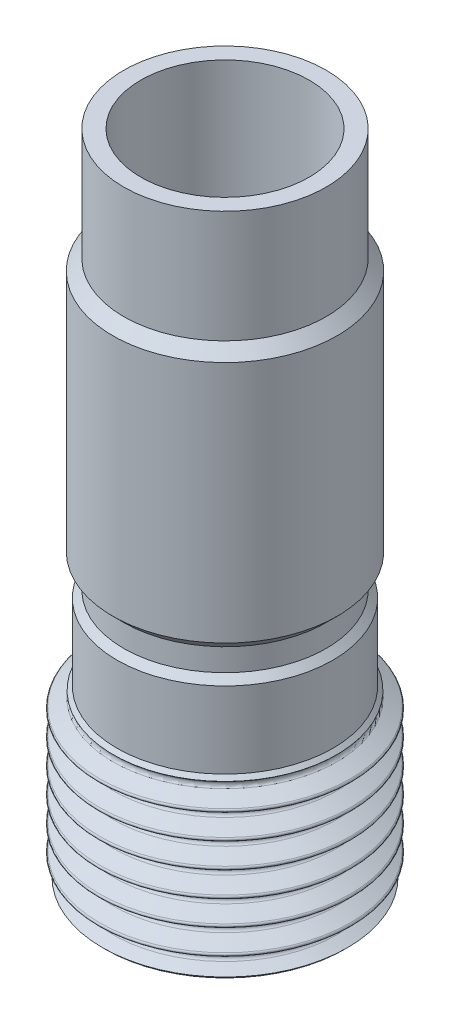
SolidWorks part; units mm, degrees
ref_plane "Front Plane" through (0, 0, 0) normal (0, 0, 1) x (1, 0, 0)
ref_plane "Top Plane" through (0, 0, 0) normal (0, 1, 0) x (1, 0, 0)
ref_plane "Right Plane" through (0, 0, 0) normal (1, 0, 0) x (0, 0, -1)
sketch "Sketch1" plane through (0, 0, 0) normal (0, 0, 1) x (1, 0, 0)
  line L0 (0, 0) -> (0, 31.3505) construction
  line L1 (-4.7625, 0) -> (-4.7625, 15.875)
  line L2 (-4.7625, 0) -> (-7.1438, 0)
  line L3 (-7.1438, 0) -> (-7.1437, 8.49)
  line L4 (-7.1437, 8.49) -> (-6.1087, 9.525)
  line L5 (-6.1087, 9.525) -> (-6.1087, 13.843)
  line L6 (-5.7277, 15.494) -> (-6.35, 16.1163)
  line L7 (-5.7277, 36.83) -> (-5.7277, 30.48)
  line L8 (-5.7277, 30.48) -> (-6.35, 29.8577)
  line L9 (-6.35, 16.1163) -> (-6.35, 29.8577)
  line L10 (-5.7277, 36.83) -> (-4.7625, 36.83)
  line L11 (-5.7277, 15.494) -> (-5.7277, 14.224)
  line L12 (-5.7277, 14.224) -> (-6.1087, 13.843)
  line L13 (-4.7625, 15.875) -> (-2.4257, 15.875)
  line L14 (-2.4257, 15.875) -> (-2.4257, 23.9959)
  line L15 (-2.4257, 23.9959) -> (-4.7625, 25.4)
  line L16 (-4.7625, 25.4) -> (-4.7625, 36.83)
  dimension "D1" = 14.2875
  dimension "D2" = 9.525
  dimension "D3" = 12.2174
  dimension "D4" = 45
  dimension "D5" = 27.305
  dimension "D6" = 1.27
  dimension "D7" = 12.7
  dimension "D8" = 36.83
  dimension "D9" = 11.4554
  dimension "D10" = 6.35
  dimension "D11" = 21.336
  dimension "D12" = 59
  dimension "D13" = 4.8514
  dimension "D14" = 15.875
  dimension "D15" = 25.4
revolve "Revolve1" add sketch "Sketch1" angle 360 about L0
chamfer "Chamfer1" distance 0.381 angle 45 2 edges at (0, 0, -7.1438) (0, 0, -4.7625)
ref_axis "Axis1" through (0, 15.4479, 0) along (0, -1, 0)
sketch "Sketch3" plane through (0, 0, 0) normal (0, 0, 1) x (1, 0, 0)
  line L0 (0, 0) -> (0, -6.3978) construction
  line L1 (-6.329, 9.3204) -> (-6.329, 8.9676) construction
  line L3 (-6.329, 8.9676) -> (-6.0235, 9.144) construction
  line L4 (-6.0235, 9.144) -> (-6.329, 9.3204) construction
  line L5 (-6.7628, 0) -> (6.7628, 0) construction
  line L6 (-7.0928, 8.5266) -> (-6.329, 8.9676)
  line L8 (-6.329, 9.3204) -> (-7.0928, 9.7614)
  line L9 (-7.1437, 9.8496) -> (-7.1437, 8.4384)
  line L10 (-6.2272, 9.144) -> (0, 9.144) construction
  line L13 (0, 9.144) -> (6.2272, 9.144) construction
  line L14 (0, 15.4479) -> (0, -2.4123) construction
  arc A0 (-6.329, 9.3204) -> (-6.329, 8.9676) centre (-6.4309, 9.144) cw
  arc A1 (-7.1437, 9.8496) -> (-7.0928, 9.7614) centre (-7.0419, 9.8496) ccw
  arc A2 (-7.0928, 8.5266) -> (-7.1437, 8.4384) centre (-7.0419, 8.4384) ccw
  arc A3 (-7.1437, 8.4384) -> (-7.0928, 8.3502) centre (-7.0419, 8.4384) ccw construction
  point P6 (-6.0235, 9.144)
  dimension "D2" = 0.1764
  dimension "D4" = 12.4544
  dimension "D5" = 1.4111
  dimension "D6" = 0.3528
  dimension "D1" = 12.0471
  dimension "D3" = 60
  dimension "D7" = 9.144
  dimension "D9" = 14.2875
revolve "Outer thread" cut sketch "Sketch3" angle 360 about L0
pattern_linear "LPattern1" count 7 spacing 1.4111 along (0, -1, 0) of "Outer thread"
sketch "Sketch4" plane through (0, 0, 0) normal (0, 0, 1) x (1, 0, 0)
  line L0 (-5.08, 5.7436) -> (-5.08, 5.1086) construction
  line L1 (-5.1258, 5.1879) -> (-5.4695, 5.3864)
  line L2 (-5.4695, 5.4658) -> (-5.1258, 5.6642)
  line L3 (-5.1258, 5.1879) -> (-5.1258, 5.0292) construction
  line L4 (0, 0) -> (0, -4.5846) construction
  line L5 (0, 15.4479) -> (0, -2.4123) construction
  line L7 (-5.08, 6.35) -> (0, 15.1488)
  line L8 (0, 15.1488) -> (0, 0)
  line L9 (0, 0) -> (-5.08, 0)
  line L10 (-5.08, 5.1086) -> (-5.08, 0)
  line L11 (-5.4695, 5.4658) -> (-5.4695, 5.3864) construction
  line L12 (-5.08, 5.7436) -> (-5.08, 6.35)
  arc A0 (-5.4695, 5.4658) -> (-5.4695, 5.3864) centre (-5.4466, 5.4261) ccw
  arc A1 (-5.1258, 5.6642) -> (-5.08, 5.7436) centre (-5.1717, 5.7436) ccw
  arc A2 (-5.08, 5.1086) -> (-5.1258, 5.1879) centre (-5.1717, 5.1086) ccw
  arc A3 (-5.08, 5.1086) -> (-5.1258, 5.0292) centre (-5.1717, 5.1086) cw construction
  dimension "D1" = 60
  dimension "D6" = 0.0794
  dimension "D9" = 0.1588
  dimension "D2" = 10.16
  dimension "D3" = 0.635
  dimension "D4" = 5.4261
  dimension "D5" = 30
  dimension "D7" = 10.9391
  dimension "D8" = 6.35
revolve "Inner thread" cut sketch "Sketch4" angle 360 about axis through (0, 15.4479, 0) along (0, -1, 0)
pattern_linear "LPattern2" count 9 spacing 0.635 along (0, -1, 0) of "Inner thread"
sketch "Sketch2" plane through (0, 0, 0) normal (0, -1, 0) x (1, 0, 0)
  line L0 (1.397, 1.397) -> (9.3236, 1.397)
  line L1 (-1.397, -8.9729) -> (1.397, -8.9729)
  line L2 (-1.397, -8.9729) -> (-1.397, -1.397)
  line L3 (-1.397, 9.3254) -> (1.397, 9.3254)
  line L4 (1.397, -8.9729) -> (1.397, -1.397)
  line L5 (-11.306, 1.397) -> (-1.397, 1.397)
  line L6 (-11.306, 1.397) -> (-11.306, -1.397)
  line L7 (-11.306, -1.397) -> (-1.397, -1.397)
  line L8 (9.3236, 1.397) -> (9.3236, -1.397)
  line L9 (-1.397, 1.397) -> (-1.397, 9.3254)
  line L10 (1.397, -1.397) -> (9.3236, -1.397)
  line L11 (1.397, 1.397) -> (1.397, 9.3254)
  line L12 (-1.397, -1.397) -> (1.397, 1.397) construction
  dimension "D1" = 2.794
extrude "Extrude1" [suppressed] cut sketch "Sketch2" against normal blind 3.175
sketch "Sketch5" [suppressed] plane through (0, 0, 0) normal (0, 0, 1) x (1, 0, 0)
  line L0 (0, 0) -> (0, 22.3857) construction
  line L1 (0, 15.4479) -> (0, -2.4123) construction
  line L2 (-6.1087, 9.525) -> (-7.1501, 8.4836)
  line L3 (6.1087, 9.525) -> (-6.1087, 9.525) construction
  line L4 (-7.1501, 8.4836) -> (-7.1501, 0)
  line L5 (-7.1501, 0) -> (-5.08, 0)
  line L6 (-5.08, 0) -> (-5.08, 6.35)
  line L7 (5.08, 6.35) -> (-5.08, 6.35) construction
  line L8 (-5.08, 6.35) -> (-6.1087, 9.525)
  line L9 (-6.6169, 0) -> (-4.9501, 0) construction
  line L10 (-6.1087, 9.525) -> (-5.747, 9.525) construction
  dimension "D1" = 45
  dimension "D2" = 14.3002
  dimension "D3" = 10.16
  dimension "D4" = 12.2174
revolve "Revolve2" [suppressed] add sketch "Sketch5" angle 360 about L0
equation "\"D2@Sketch3\"=\"D5@Sketch3\"*.125"
equation "\"D6@Sketch3\"=\"D5@Sketch3\"*.25"
equation "\"D6@Sketch4\"=\"D3@Sketch4\"*.125"
equation "\"D9@Sketch4\"=\"D3@Sketch4\"*.25"
